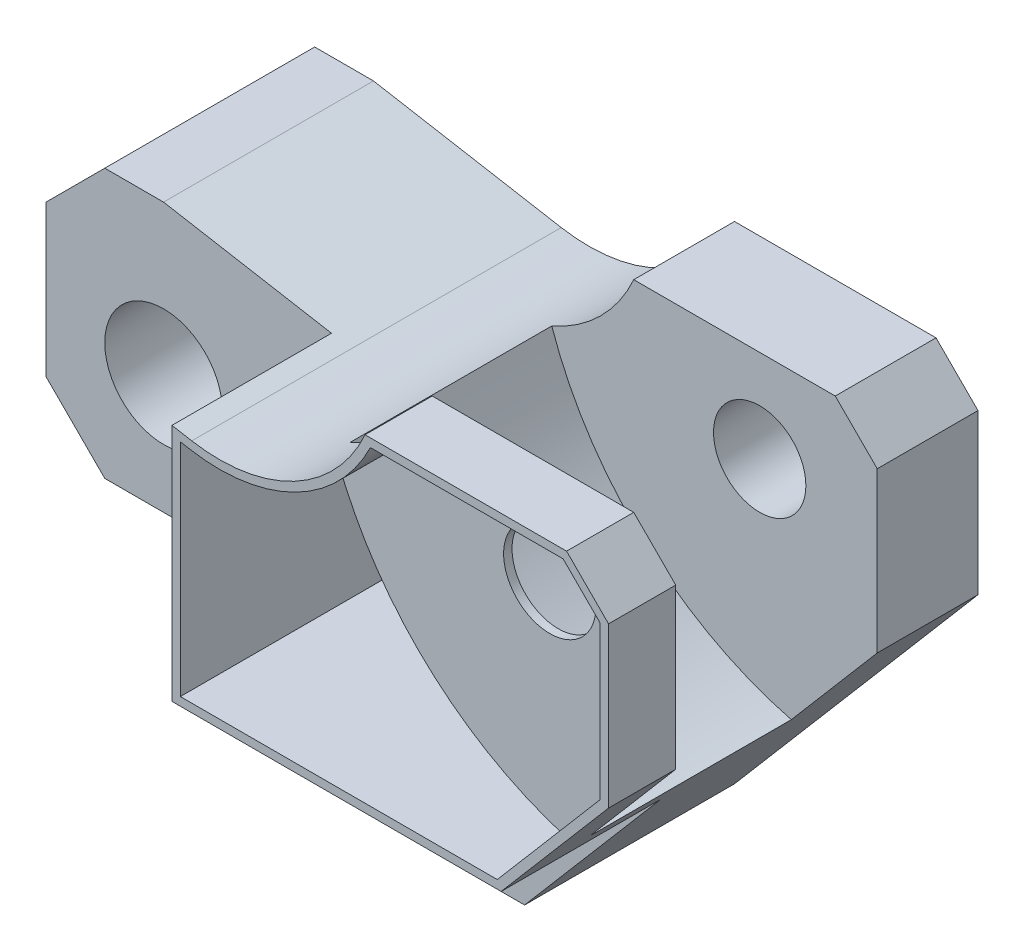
SolidWorks part; units mm, degrees
ref_plane "Front Plane" through (0, 0, 0) normal (0, 0, 1) x (1, 0, 0)
ref_plane "Top Plane" through (0, 0, 0) normal (0, 1, 0) x (1, 0, 0)
ref_plane "Right Plane" through (0, 0, 0) normal (1, 0, 0) x (0, 0, -1)
sketch "Esquisse1" plane through (0, 0, 0) normal (0, 0, 1) x (1, 0, 0)
  line L0 (14.66, 28.604) -> (38.66, 28.604)
  line L1 (38.66, 28.604) -> (43.66, 23.604)
  line L2 (43.66, 23.604) -> (43.66, 4.604)
  line L3 (43.66, 4.604) -> (14.66, -29.396)
  line L4 (14.66, -29.396) -> (8.957, -29.396)
  line L5 (-2.7645, -10.396) -> (-35.34, -10.396)
  line L6 (-35.34, -10.396) -> (-42.34, -3.396)
  line L7 (-42.34, -3.396) -> (-42.34, 14.604)
  line L8 (-42.34, 14.604) -> (-35.34, 21.604)
  line L9 (-35.34, 21.604) -> (-28.34, 21.604)
  line L10 (-28.34, 21.604) -> (-5.9786, 17.6611)
  arc A0 (8.957, -29.396) -> (2.1812, -14.6607) centre (30.8659, -10.396) cw
  arc A1 (2.1812, -14.6607) -> (-2.7645, -10.396) centre (-2.7645, -15.396) ccw
  arc A2 (-5.9786, 17.6611) -> (14.66, 28.604) centre (-2.6793, 36.3724) ccw
  circle A3 centre (-28.34, 3.604) radius 7
  dimension "D5" = 29
  dimension "D15" = 5
  dimension "D19" = 19
  dimension "D20" = 14
  dimension "D1" = 29
  dimension "D2" = 135
  dimension "D3" = 5
  dimension "D4" = 24
  dimension "D6" = 19
  dimension "D7" = 29
  dimension "D8" = 86
  dimension "D9" = 7
  dimension "D10" = 32
  dimension "D11" = 135
  dimension "D12" = 7
  dimension "D13" = 14
  dimension "D14" = 190
  dimension "D16" = 58
  dimension "D17" = 14
  dimension "D18" = 14
  dimension "D21" = 19
  dimension "D22" = 135
extrude "Boss.-Extru.1" add sketch "Esquisse1" along normal blind 44
sketch "Esquisse2" plane through (0, 0, 44) normal (0, 0, 1) x (1, 0, 0)
  line L0 (-8.34, 18.0775) -> (-8.34, -10.396)
  line L1 (-2.7645, -10.396) -> (30.8659, -10.396)
  line L11 (-5.9786, 17.6611) -> (-28.34, 21.604)
  line L12 (-28.34, 21.604) -> (-35.34, 21.604)
  line L13 (-35.34, 21.604) -> (-42.34, 14.604)
  line L14 (-42.34, 14.604) -> (-42.34, -3.396)
  line L15 (-42.34, -3.396) -> (-35.34, -10.396)
  line L16 (-35.34, -10.396) -> (-2.7645, -10.396)
  line L17 (8.957, -29.396) -> (14.66, -29.396)
  line L18 (14.66, -29.396) -> (43.66, 4.604)
  line L19 (43.66, 4.604) -> (43.66, 23.604)
  line L20 (43.66, 23.604) -> (38.66, 28.604)
  line L21 (38.66, 28.604) -> (14.66, 28.604)
  line L22 (-8.34, 18.0775) -> (-28.34, 21.604)
  line L23 (-28.34, 21.604) -> (-35.34, 21.604)
  line L24 (-35.34, 21.604) -> (-42.34, 14.604)
  line L25 (-42.34, 14.604) -> (-42.34, -3.396)
  line L26 (-42.34, -3.396) -> (-35.34, -10.396)
  line L27 (-35.34, -10.396) -> (-8.34, -10.396)
  line L28 (8.957, -29.396) -> (14.66, -29.396)
  line L29 (14.66, -29.396) -> (30.8659, -10.396)
  arc A3 (-5.9786, 17.6611) -> (14.66, 28.604) centre (-2.6793, 36.3724) ccw
  arc A4 (2.1812, -14.6607) -> (-2.7645, -10.396) centre (-2.7645, -15.396) ccw
  arc A5 (2.1812, -14.6607) -> (8.957, -29.396) centre (30.8659, -10.396) ccw
  arc A7 (2.1812, -14.6607) -> (-2.7645, -10.396) centre (-2.7645, -15.396) ccw
  arc A8 (2.1812, -14.6607) -> (8.957, -29.396) centre (30.8659, -10.396) ccw
  dimension "D1" = 0
extrude "Enlèv. mat.-Extru.1" cut sketch "Esquisse2" against normal blind 19
sketch "Esquisse3" plane through (0, 0, 44) normal (0, 0, 1) x (1, 0, 0)
  line L0 (43.66, 4.604) -> (43.66, 23.604) construction
  line L1 (38.66, 28.604) -> (14.66, 28.604) construction
  circle A0 centre (29.66, 17.604) radius 5.5
  dimension "D1" = 11
  dimension "D2" = 14
  dimension "D3" = 11
extrude "Enlèv. mat.-Extru.2" cut sketch "Esquisse3" against normal blind 62
ref_plane "Plan1" through (0, 0, 12) normal (0, 0, -1) x (-1, 0, 0)
sketch "Esquisse4" plane through (0, 0, 12) normal (0, 0, -1) x (-1, 0, 0)
  line L11 (-14.66, 28.604) -> (-38.66, 28.604)
  line L12 (-38.66, 28.604) -> (-43.66, 23.604)
  line L13 (-43.66, 23.604) -> (-43.66, 4.604)
  line L14 (-43.66, 4.604) -> (-14.66, -29.396)
  line L15 (-14.66, -29.396) -> (-8.957, -29.396)
  line L16 (2.7645, -10.396) -> (35.34, -10.396)
  line L17 (35.34, -10.396) -> (42.34, -3.396)
  line L18 (42.34, -3.396) -> (42.34, 14.604)
  line L19 (42.34, 14.604) -> (35.34, 21.604)
  line L20 (35.34, 21.604) -> (28.34, 21.604)
  line L21 (28.34, 21.604) -> (5.9786, 17.6611)
  line L22 (-14.66, 28.604) -> (-38.66, 28.604)
  line L23 (-38.66, 28.604) -> (-43.66, 23.604)
  line L24 (-43.66, 23.604) -> (-43.66, 4.604)
  line L25 (-43.66, 4.604) -> (-33.4247, -7.396)
  arc A0 (-33.4247, -7.396) -> (-4.8969, 18.9483) centre (-43.66, 32.3059) ccw
  arc A4 (-14.66, 28.604) -> (5.9786, 17.6611) centre (2.6793, 36.3724) ccw
  arc A5 (-8.957, -29.396) -> (-2.1812, -14.6607) centre (-30.8659, -10.396) ccw
  arc A6 (2.7645, -10.396) -> (-2.1812, -14.6607) centre (2.7645, -15.396) ccw
  arc A7 (-14.66, 28.604) -> (-4.8969, 18.9483) centre (2.6793, 36.3724) ccw
  dimension "D1" = 82
  dimension "D4" = 41
  dimension "D3" = 36
  dimension "D2" = 0
extrude "Enlèv. mat.-Extru.3" cut sketch "Esquisse4" against normal blind 24
sketch "Esquisse5" plane through (0, 0, 44) normal (0, 0, 1) x (1, 0, 0)
  line L2 (-7.34, 16.8857) -> (-7.34, -9.396)
  line L3 (-7.34, -9.396) -> (30.4045, -9.396)
  line L4 (30.4045, -9.396) -> (42.66, 4.9725)
  line L5 (42.66, 4.9725) -> (42.66, 23.1898)
  line L6 (42.66, 23.1898) -> (38.2458, 27.604)
  line L21 (38.2458, 27.604) -> (15.2961, 27.604)
  line L22 (-6.1523, 16.6763) -> (-7.34, 16.8857)
  arc A4 (-6.1523, 16.6763) -> (15.2961, 27.604) centre (-2.6793, 36.3724) ccw
extrude "Enlèv. mat.-Extru.4" cut sketch "Esquisse5" against normal blind 7
sketch "Esquisse6" plane through (0, 0, 37) normal (0, 0, 1) x (1, 0, 0)
  line L21 (-6.1523, 16.6763) -> (-7.34, 16.8857)
  line L22 (-7.34, 16.8857) -> (-7.34, -9.396)
  line L23 (-7.34, -9.396) -> (30.4045, -9.396)
  line L24 (30.4045, -9.396) -> (42.66, 4.9725)
  line L25 (42.66, 4.9725) -> (42.66, 23.1898)
  line L26 (42.66, 23.1898) -> (38.2458, 27.604)
  line L27 (38.2458, 27.604) -> (15.2961, 27.604)
  line L28 (-6.1523, 16.6763) -> (-7.34, 16.8857)
  line L29 (-7.34, 16.8857) -> (-7.34, -9.396)
  line L30 (-7.34, -9.396) -> (30.4045, -9.396)
  line L31 (30.4045, -9.396) -> (31.6468, -7.9394)
  arc A2 (4.3067, 17.6322) -> (31.6468, -7.9394) centre (43.66, 32.3059) ccw
  arc A6 (-6.1523, 16.6763) -> (15.2961, 27.604) centre (-2.6793, 36.3724) ccw
  arc A7 (-6.1523, 16.6763) -> (4.3067, 17.6322) centre (-2.6793, 36.3724) ccw
  dimension "D2" = 0
extrude "Enlèv. mat.-Extru.5" cut sketch "Esquisse6" against normal blind 25
